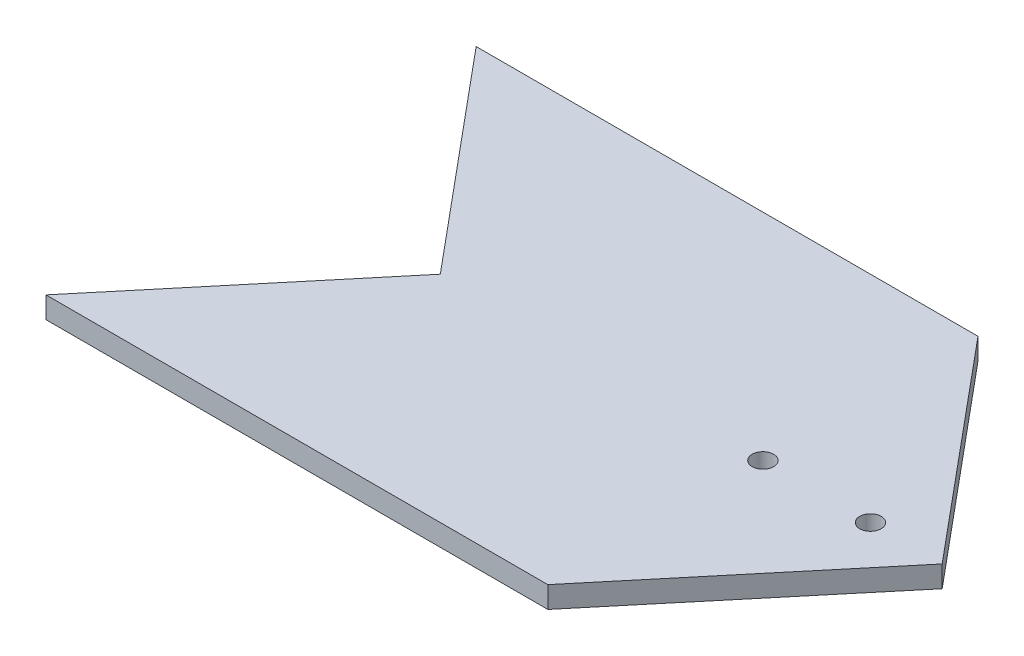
SolidWorks part; units mm, degrees
ref_plane "Front" through (0, 0, 0) normal (0, 0, 1) x (1, 0, 0)
ref_plane "Top" through (0, 0, 0) normal (0, 1, 0) x (1, 0, 0)
ref_plane "Right" through (0, 0, 0) normal (1, 0, 0) x (0, 0, -1)
sketch "Sketch1" plane through (0, 0, 0) normal (0, 1, 0) x (1, 0, 0)
  line L1 (0, 0) -> (70, 0)
  line L3 (0, 60) -> (70, 60)
  line L8 (95, 30) -> (70, 60)
  line L9 (95, 30) -> (70, 0)
  line L10 (0, 60) -> (25, 30)
  line L11 (25, 30) -> (0, 0)
  circle A0 centre (85, 30) radius 1.5
  circle A1 centre (70, 30) radius 1.5
extrude "Extrude1" add sketch "Sketch1" along normal blind 3
